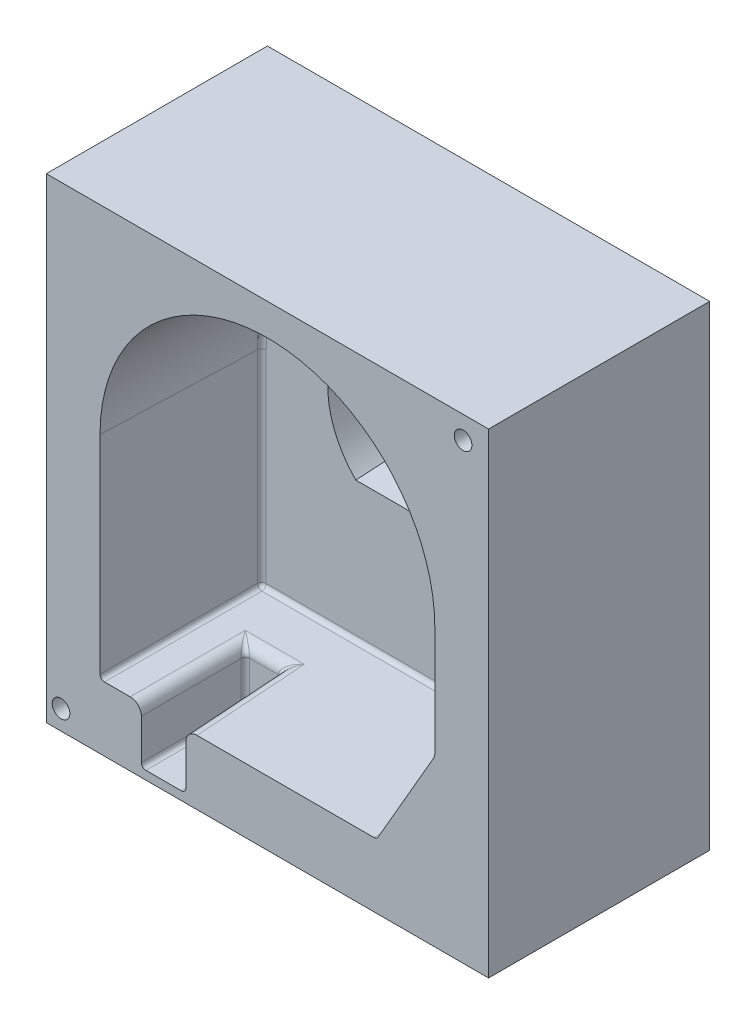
SolidWorks part; units mm, degrees
ref_plane "Plan de face" through (0, 0, 0) normal (0, 0, 1) x (1, 0, 0)
ref_plane "Plan de dessus" through (0, 0, 0) normal (0, 1, 0) x (1, 0, 0)
ref_plane "Plan de droite" through (0, 0, 0) normal (1, 0, 0) x (0, 0, -1)
body saved out of another part "Stock-MoulePlein-1"
